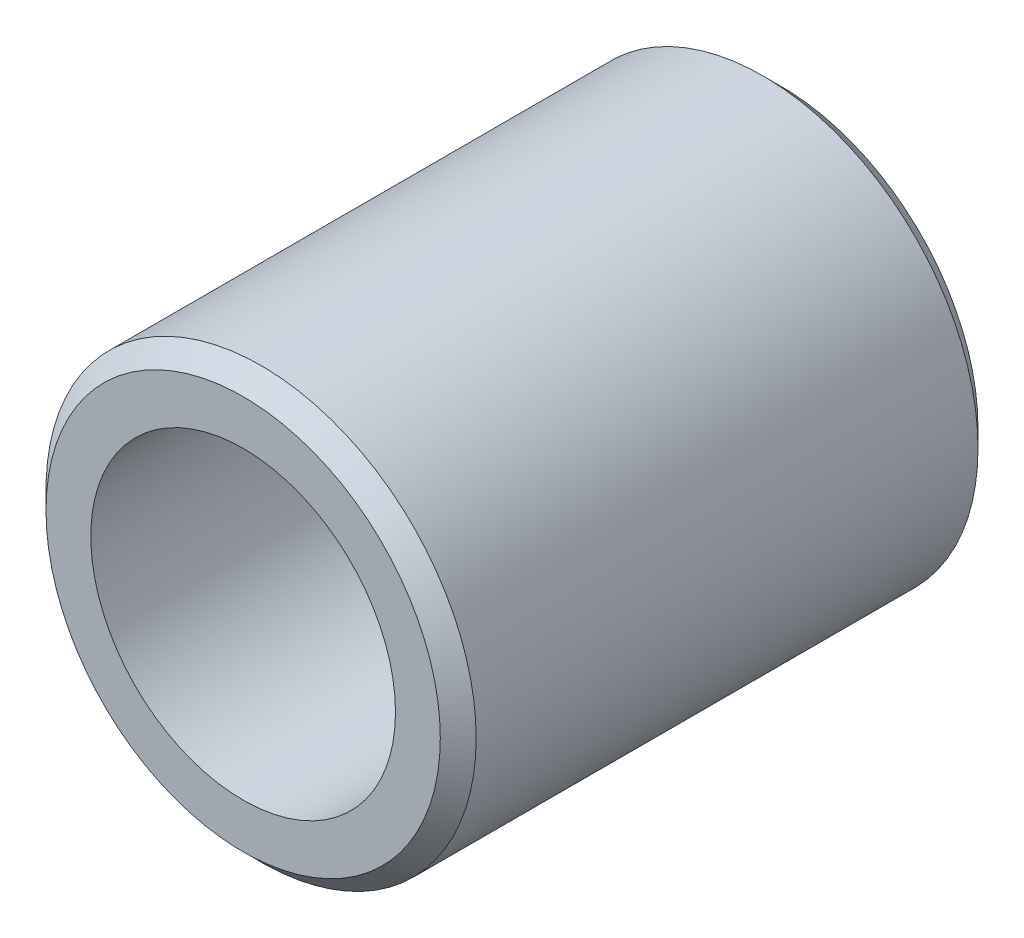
SolidWorks part; units mm, degrees
ref_plane "Plan de face" through (0, 0, 0) normal (0, 0, 1) x (1, 0, 0)
ref_plane "Plan de dessus" through (0, 0, 0) normal (0, 1, 0) x (1, 0, 0)
ref_plane "Plan de droite" through (0, 0, 0) normal (1, 0, 0) x (0, 0, -1)
sketch "Esquisse1" plane through (0, 0, 0) normal (0, 0, 1) x (1, 0, 0)
  circle A0 centre (0, 0) radius 6
  circle A1 centre (0, 0) radius 4.25
  dimension "D1" = 12
  dimension "D2" = 8.5
extrude "Boss.-Extru.1" add sketch "Esquisse1" along normal blind 15
chamfer "Chanfrein1" distance 0.5 angle 45 2 edges at (6, 0, 15) (6, 0, 0)
